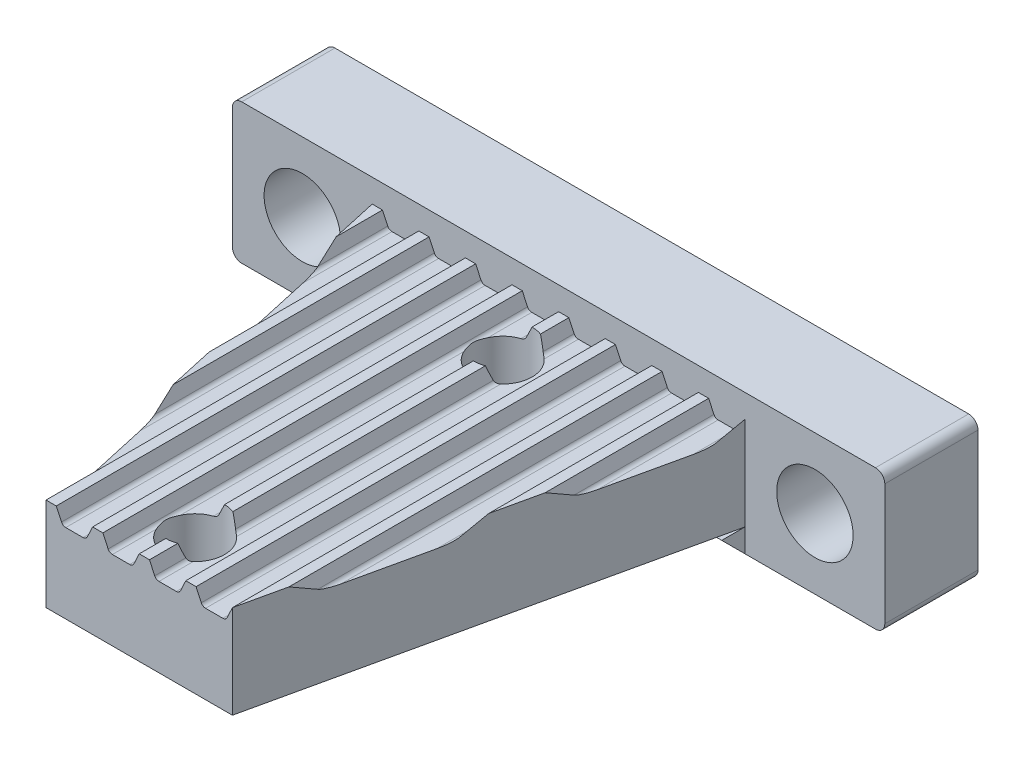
SolidWorks part; units mm, degrees
ref_plane "Plan de face" through (0, 0, 0) normal (0, 0, 1) x (1, 0, 0)
ref_plane "Plan de dessus" through (0, 0, 0) normal (0, 1, 0) x (1, 0, 0)
ref_plane "Plan de droite" through (0, 0, 0) normal (1, 0, 0) x (0, 0, -1)
sketch "Esquisse1" plane through (0, 0, 0) normal (0, 0, 1) x (1, 0, 0)
  line L1 (0, 0) -> (110, 0)
  line L2 (0, 0) -> (0, -15)
  line L3 (0, -15) -> (110, -15)
  line L4 (110, 0) -> (110, -15)
  dimension "D1" = 15
  dimension "D2" = 110
extrude "Boss.-Extru.1" add sketch "Esquisse1" along normal blind 10
sketch "Esquisse2" plane through (0, 0, 10) normal (0, 0, 1) x (1, 0, 0)
  line L1 (15, -2.5) -> (95, -2.5)
  line L2 (15, -2.5) -> (15, -12.5)
  line L3 (15, -12.5) -> (95, -12.5)
  line L4 (95, -2.5) -> (95, -12.5)
  line L5 (110, -15) -> (110, 0) construction
  line L6 (0, 0) -> (0, -15) construction
  point P8 (0, -7.5)
  point P9 (15, -7.5)
  dimension "D1" = 10
  dimension "D2" = 80
  dimension "D3" = 15
extrude "Boss.-Extru.2" add sketch "Esquisse2" along normal blind 45
sketch "Esquisse3" plane through (0, 0, 55) normal (0, 0, 1) x (1, 0, 0)
  line L0 (21.1011, -2.5) -> (20, -2.5) construction
  line L1 (16.1011, -2.5) -> (20, -2.5)
  line L6 (20, -2.5) -> (19.4352, -3.7113)
  line L7 (18.982, -4) -> (17.1191, -4)
  line L8 (16.6659, -3.7113) -> (16.1011, -2.5)
  line L9 (16.1011, -2.5) -> (15, -2.5) construction
  arc A0 (19.4352, -3.7113) -> (18.982, -4) centre (18.982, -3.5) cw
  arc A1 (17.1191, -4) -> (16.6659, -3.7113) centre (17.1191, -3.5) cw
  dimension "D5" = 0.5
  dimension "D6" = 0.5
  dimension "D1" = 1.8629
  dimension "D2" = 115
  dimension "D3" = 115
  dimension "D4" = 1.5
  dimension "D7" = 3.8989
  dimension "D8" = 1.1011
  dimension "D9" = 1.1011
extrude "Enlèv. mat.-Extru.1" cut sketch "Esquisse3" against normal blind 45
pattern_linear "Répétition linéaire1" count 19 spacing 5 along (1, 0, 0) of "Enlèv. mat.-Extru.1"
sketch "Esquisse5" plane through (0, -12.5, 0) normal (0, -1, 0) x (-1, 0, 0)
  line L0 (-85, -55) -> (-95, -10)
  line L2 (-95, -10) -> (-95, -55)
  line L3 (-95, -55) -> (-85, -55)
  line L4 (-15, -55) -> (-15, -10)
  line L5 (-15, -10) -> (-25, -55)
  line L6 (-25, -55) -> (-15, -55)
  dimension "D1" = 10
  dimension "D2" = 10
extrude "Enlèv. mat.-Extru.2" cut sketch "Esquisse5" against normal blind 45
sketch "Esquisse6" plane through (0, -12.5, 0) normal (0, -1, 0) x (1, 0, 0)
  line L1 (35, 16) -> (75, 16) construction
  line L2 (35, 16) -> (35, 49) construction
  line L3 (35, 49) -> (75, 49) construction
  line L4 (75, 16) -> (75, 49) construction
  line L6 (25, 55) -> (85, 55) construction
  circle A0 centre (35, 16) radius 3.15
  circle A1 centre (35, 49) radius 3.15
  circle A2 centre (75, 16) radius 3.15
  circle A3 centre (75, 49) radius 3.15
  point P7 (55, 49)
  point P18 (55, 55)
  dimension "D3" = 6.3
  dimension "D4" = 6
  dimension "D1" = 33
  dimension "D2" = 40
extrude "Enlèv. mat.-Extru.3" cut sketch "Esquisse6" against normal through all
chamfer "Chanfrein1" distance 2.5 angle 45 1 edges at (55, -12.5, 10)
sketch "Esquisse7" plane through (0, -12.5, 0) normal (0, -1, 0) x (1, 0, 0)
  circle A0 centre (35, 16) radius 5
  circle A1 centre (75, 16) radius 5
  dimension "D1" = 10
extrude "Enlèv. mat.-Extru.4" cut sketch "Esquisse7" along normal through all
sketch "Esquisse8" plane through (0, 0, 10) normal (0, 0, 1) x (1, 0, 0)
  line L0 (110, -15) -> (110, 0) construction
  line L2 (95, -15) -> (110, -15) construction
  line L3 (0, 0) -> (0, -15) construction
  circle A0 centre (7.5, -7.5) radius 4.1
  circle A1 centre (102.5, -7.5) radius 4.1
  dimension "D1" = 8.2
  dimension "D3" = 7.5
  dimension "D4" = 7.5
  dimension "D2" = 7.5
extrude "Enlèv. mat.-Extru.5" cut sketch "Esquisse8" against normal through all
fillet "Congé1" radius 1 4 edges at (110, -15, 5) (0, -15, 5) (0, 0, 5) (110, 0, 5)
sketch "Esquisse9" plane through (0, -15, 0) normal (0, -1, 0) x (-1, 0, 0)
  line L0 (-1, 0) -> (-109, 0) construction
  line L1 (-55, 0) -> (-135, 0)
  line L2 (-55, 0) -> (-55, -80)
  line L3 (-55, -80) -> (-135, -80)
  line L4 (-135, 0) -> (-135, -80)
  dimension "D1" = 80
  dimension "D2" = 80
extrude "Enlèv. mat.-Extru.6" cut sketch "Esquisse9" against normal through all
sketch "Esquisse10" plane through (55, 0, 0) normal (1, 0, 0) x (0, 0, -1)
  line L1 (0, -15) -> (-10, -15)
  line L2 (0, -15) -> (0, 0)
  line L3 (0, 0) -> (-10, 0)
  line L4 (-10, -15) -> (-10, 0)
extrude "Boss.-Extru.3" add sketch "Esquisse10" along normal blind 15
sketch "Esquisse11" plane through (0, 0, 10) normal (0, 0, 1) x (1, 0, 0)
  line L0 (70, 0) -> (70, -15) construction
  line L1 (70, 0) -> (1, 0) construction
  circle A0 centre (62.5, -7.5) radius 4.1
  dimension "D1" = 8.2
  dimension "D2" = 7.5
  dimension "D3" = 7.5
extrude "Enlèv. mat.-Extru.7" cut sketch "Esquisse11" against normal blind 15
fillet "Congé2" radius 1 2 edges at (70, -15, 5) (70, 0, 5)
sketch "Esquisse12" plane through (0, -12.5, 0) normal (0, -1, 0) x (-1, 0, 0)
  line L0 (-45, -55) -> (-55, -10)
  line L1 (-25, -55) -> (-55, -55) construction
  line L2 (-55, -10) -> (-55, -55)
  line L3 (-55, -55) -> (-45, -55)
  dimension "D1" = 10
extrude "Enlèv. mat.-Extru.8" cut sketch "Esquisse12" against normal through all
